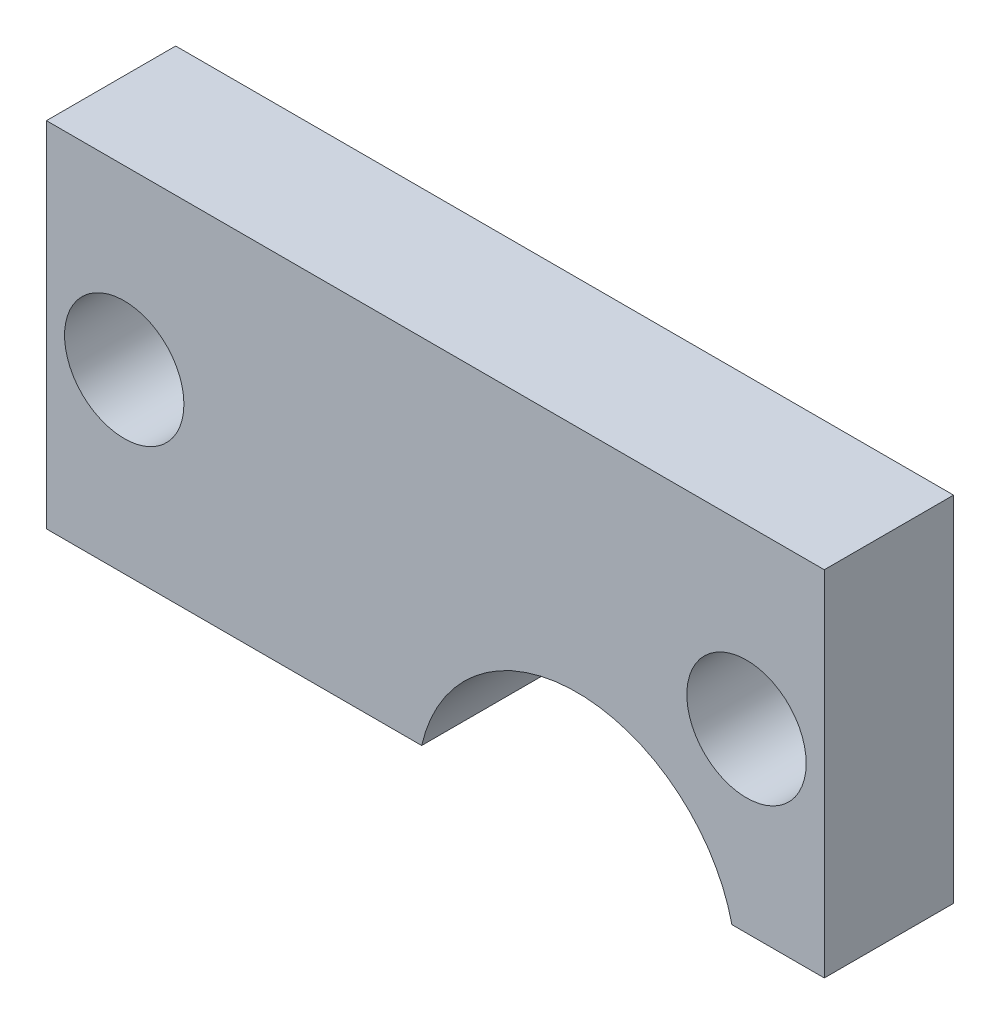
SolidWorks part; units mm, degrees
ref_plane "Front" through (0, 0, 0) normal (0, 0, 1) x (1, 0, 0)
ref_plane "Top" through (0, 0, 0) normal (0, 1, 0) x (1, 0, 0)
ref_plane "Right" through (0, 0, 0) normal (1, 0, 0) x (0, 0, -1)
sketch "Sketch1" plane through (0, 0, 0) normal (0, 0, 1) x (1, 0, 0)
  line L1 (-693.42, -120.65) -> (-623.57, -120.65)
  line L2 (-693.42, -120.65) -> (-693.42, -152.4)
  line L3 (-693.42, -152.4) -> (-623.57, -152.4)
  line L4 (-623.57, -120.65) -> (-623.57, -152.4)
  line L5 (-741.045, 25.4) -> (-455.295, 25.4) construction
  line L6 (-744.22, 149.225) -> (-744.22, -180.975) construction
  dimension "D1" = 146.05
  dimension "D2" = 69.85
  dimension "D3" = 31.75
  dimension "D4" = 50.8
extrude "Boss-Extrude1" add sketch "Sketch1" along normal blind 11.6082 separate body
hole_wizard "Hole11" positions "Point_Sketch1" profile "Profil_Sketch1" counterbore size "1/4" standard "ANSI Inch"
sketch "Point_Sketch1" plane through (-746.9291, -135.59, 11.6082) normal (0, 0, -1) x (1, 0, 0)
  point P0 (60.4941, 0.935)
  point P2 (116.3741, 0.935)
sketch "Profil_Sketch1" plane through (-686.435, -136.525, 11.6082) normal (1, 0, 0) x (0, -1, 0)
  line L0 (0, 0) -> (0, 11.6082)
  line L1 (0, 11.6082) -> (3.5687, 11.6082)
  line L3 (3.5687, 11.6082) -> (3.5687, 7.874)
  line L4 (3.5687, 7.874) -> (5.3594, 7.874)
  line L5 (5.3594, 7.874) -> (5.3594, 0)
  line L7 (5.3594, 0) -> (0, 0)
  line L11 (0, -6.35) -> (0, 107.95) construction
  dimension "Diameter" = 7.1374
  dimension "Thru Hole Depth" = 11.6082
  dimension "L1" = 7.874
other "usin_LS160_.25-20x.625-SHCS<1>"
sketch "Sketch8" plane through (0, 0, 11.6082) normal (0, 0, 1) x (1, 0, 0)
  circle A0 centre (-645.795, -155.575) radius 14.2875
  dimension "D1" = 28.575
extrude "Cut-Extrude1" cut sketch "Sketch8" against normal through all
